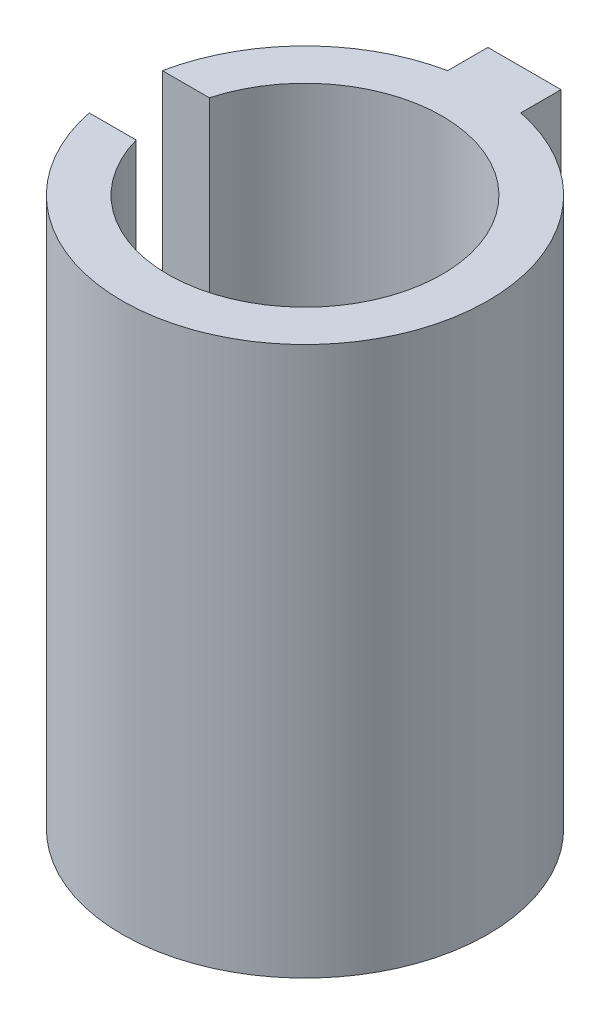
SolidWorks part; units mm, degrees
ref_plane "Front Plane" through (0, 0, 0) normal (0, 0, 1) x (1, 0, 0)
ref_plane "Top Plane" through (0, 0, 0) normal (0, 1, 0) x (1, 0, 0)
ref_plane "Right Plane" through (0, 0, 0) normal (1, 0, 0) x (0, 0, -1)
sketch "Sketch1" plane through (0, 0, 0) normal (0, 1, 0) x (1, 0, 0)
  line L0 (0, 0) -> (-13.9193, 0) construction
  line L1 (-7.2284, 2) -> (-9.798, 2)
  line L2 (-7.2284, -2) -> (-9.798, -2)
  line L3 (0, 0) -> (0, 12) construction
  line L4 (2, 9.798) -> (2, 12)
  line L5 (0, 2) -> (-13.9193, 2) construction
  line L6 (0, -2) -> (-13.9193, -2) construction
  line L7 (-2, 9.798) -> (-2, 12)
  line L9 (2, 12) -> (-2, 12)
  line L10 (-2, 0) -> (-2, 12) construction
  line L11 (2, 0) -> (2, 12) construction
  arc A0 (-9.798, -2) -> (2, 9.798) centre (0, 0) ccw
  arc A1 (-7.2284, -2) -> (-7.2284, 2) centre (0, 0) ccw
  arc A2 (-2, 9.798) -> (-9.798, 2) centre (0, 0) ccw
  dimension "D1" = 20
  dimension "D2" = 15
  dimension "D5" = 12
  dimension "D3" = 2
  dimension "D4" = 2
  dimension "D6" = 2
  dimension "D7" = 2
extrude "Extrude1" add sketch "Sketch1" along normal blind 30
